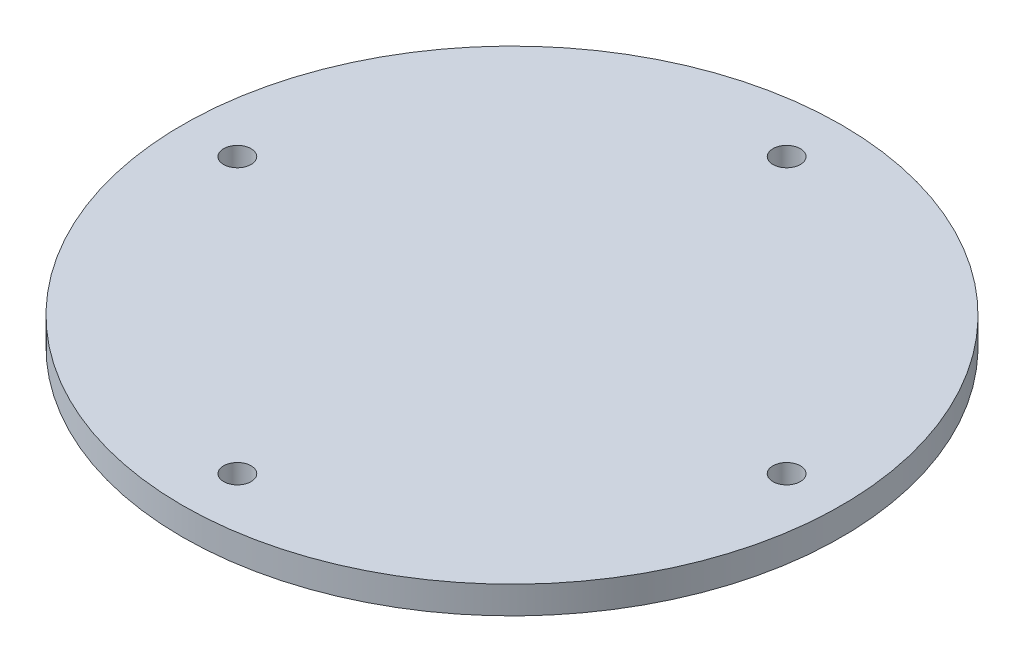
SolidWorks part; units mm, degrees
ref_plane "Front Plane" through (0, 0, 0) normal (0, 0, 1) x (1, 0, 0)
ref_plane "Top Plane" through (0, 0, 0) normal (0, 1, 0) x (1, 0, 0)
ref_plane "Right Plane" through (0, 0, 0) normal (1, 0, 0) x (0, 0, -1)
sketch "Sketch1" plane through (0, 0, 0) normal (0, 1, 0) x (1, 0, 0)
  circle A0 centre (0, 0) radius 30
  circle A1 centre (0, 0) radius 25 construction
  circle A2 centre (0, 25) radius 1.25
  circle A3 centre (25, 0) radius 1.25
  circle A4 centre (0, -25) radius 1.25
  circle A5 centre (-25, 0) radius 1.25
  point P15 (0, 0)
  dimension "D1" = 60
  dimension "D2" = 50
  dimension "D3" = 2.5
  dimension "D4" = 4
extrude "Boss-Extrude1" add sketch "Sketch1" along normal blind 2.5
